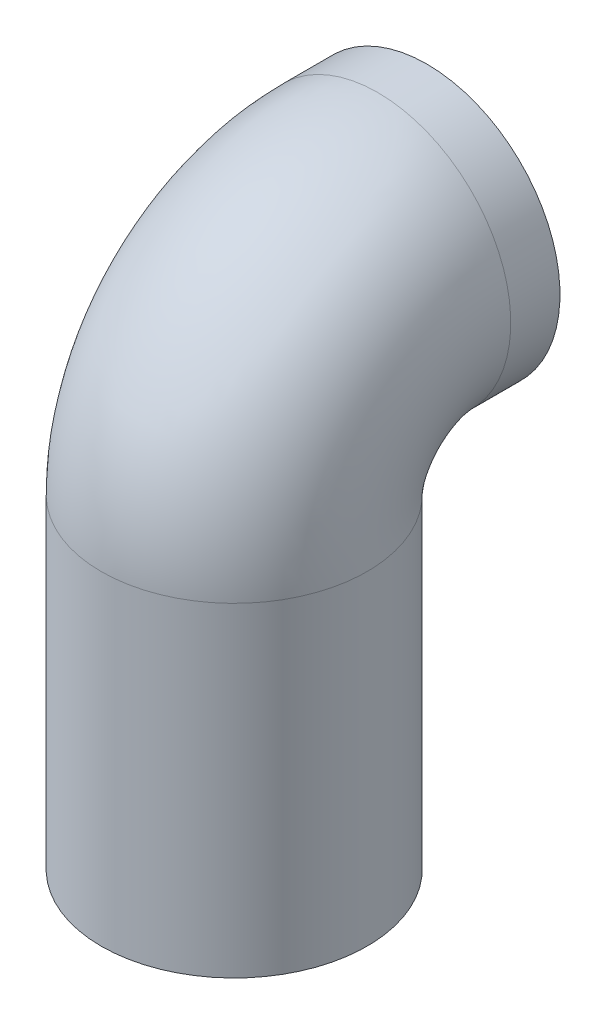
SolidWorks part; units mm, degrees
ref_plane "Front Plane" through (0, 0, 0) normal (0, 0, 1) x (1, 0, 0)
ref_plane "Top Plane" through (0, 0, 0) normal (0, 1, 0) x (1, 0, 0)
ref_plane "Right Plane" through (0, 0, 0) normal (1, 0, 0) x (0, 0, -1)
sketch "Sketch1" plane through (0, 0, 0) normal (0, 1, 0) x (1, 0, 0)
  circle A0 centre (0, 0) radius 25
  dimension "D1" = 50
extrude "Extrude1" add sketch "Sketch1" along normal blind 61
sketch "Sketch2" plane through (0, 0, 0) normal (1, 0, 0) x (0, 0, -1)
  line L1 (0, 0) -> (0, 39.4866) construction
  line L2 (25, 61) -> (-25, 61) construction
  line L5 (27, 61) -> (27, 49.1497) construction
  line L6 (27, 61) -> (-30.1044, 61) construction
  arc A0 (27, 88) -> (0, 61) centre (27, 61) ccw
  dimension "D1" = 27
sketch "Sketch3" plane through (0, 61, 0) normal (0, 1, 0) x (-1, 0, 0)
  circle A1 centre (0, 0) radius 25
  circle A2 centre (0, 0) radius 25
  dimension "D1" = 0
sweep "Sweep1" add profiles "Sketch3" path "Sketch2"
sketch "Sketch4" plane through (0, 0, -27) normal (0, 0, -1) x (-1, 0, 0)
  circle A1 centre (0, 88) radius 25
  circle A2 centre (0, 88) radius 25
  dimension "D1" = 0
extrude "Extrude2" add sketch "Sketch4" along normal blind 9.25
